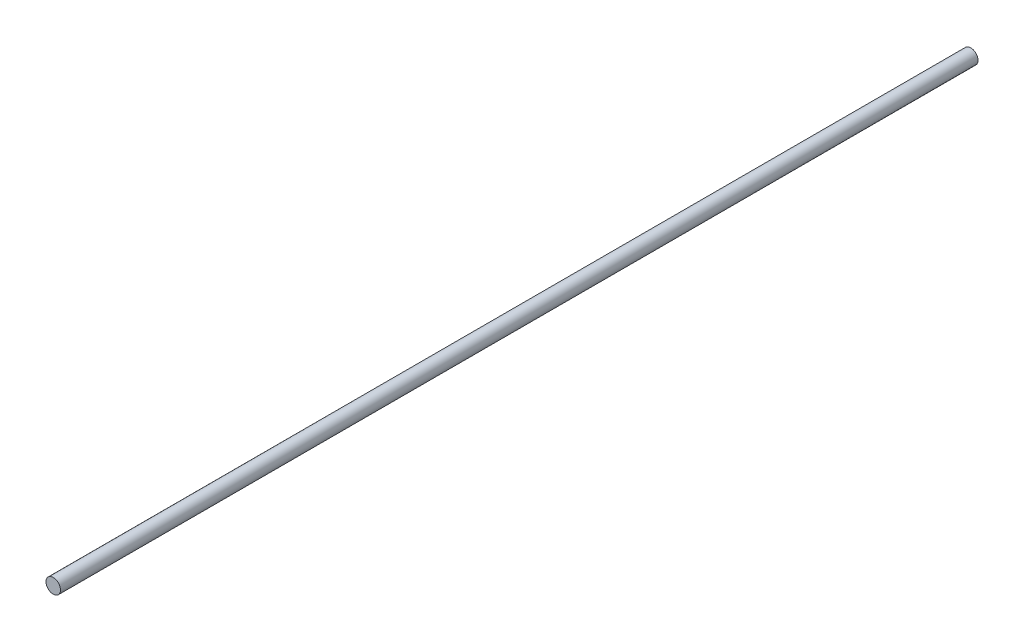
SolidWorks part; units mm, degrees
ref_plane "Front Plane" through (0, 0, 0) normal (0, 0, 1) x (1, 0, 0)
ref_plane "Top Plane" through (0, 0, 0) normal (0, 1, 0) x (1, 0, 0)
ref_plane "Right Plane" through (0, 0, 0) normal (1, 0, 0) x (0, 0, -1)
sketch "Sketch1" plane through (0, 0, 0) normal (0, 0, 1) x (1, 0, 0)
  circle A0 centre (0, 0) radius 30
  dimension "D1" = 60
extrude "Boss-Extrude1" add sketch "Sketch1" against normal blind 3800
